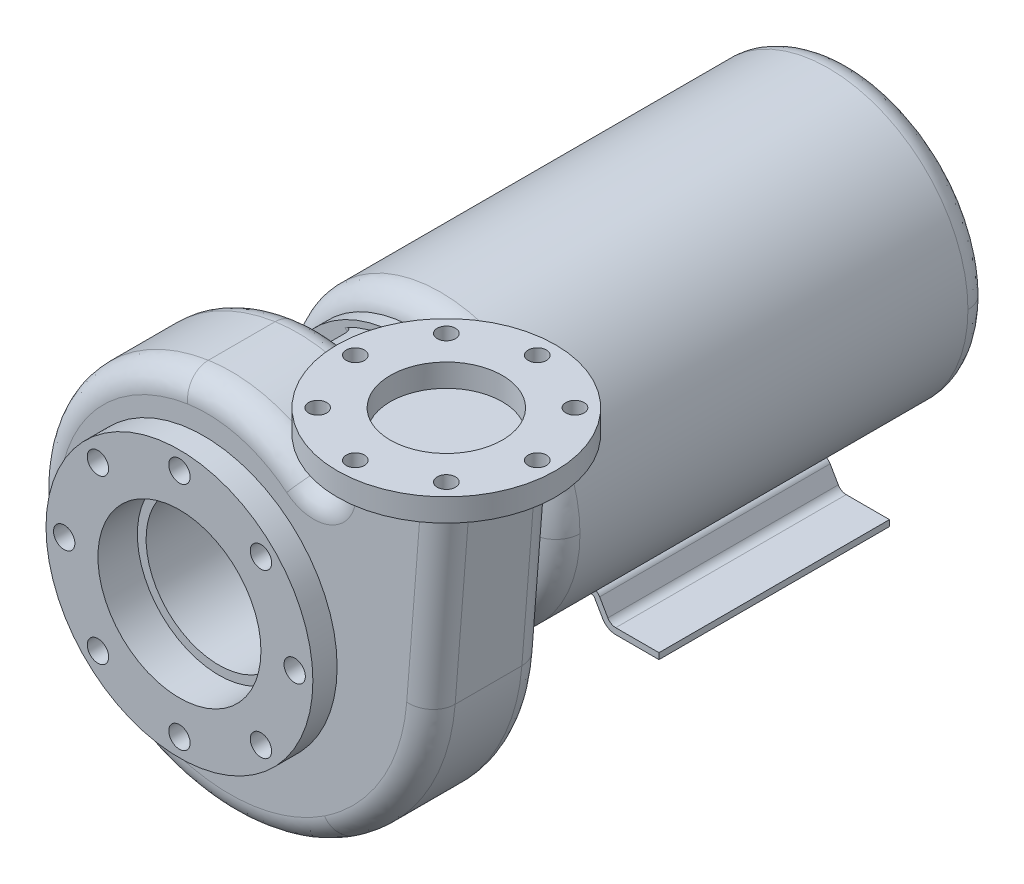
SolidWorks part; units mm, degrees
ref_plane "Front Plane" through (0, 0, 0) normal (0, 0, 1) x (1, 0, 0)
ref_plane "Top Plane" through (0, 0, 0) normal (0, 1, 0) x (1, 0, 0)
ref_plane "Right Plane" through (0, 0, 0) normal (1, 0, 0) x (0, 0, -1)
imported_body "Imported1"
sketch "Sketch1" plane through (0, 0, 76.2) normal (0, 0, 1) x (1, 0, 0)
  circle A0 centre (0, 0) radius 139.7
  dimension "D1" = 279.4
extrude "Extrude1" add sketch "Sketch1" along normal blind 25.4
sketch "Sketch2" plane through (0, 0, 101.6) normal (0, 0, 1) x (1, 0, 0)
  circle A0 centre (0, 0) radius 85.344
  dimension "D1" = 170.688
extrude "Extrude2" cut sketch "Sketch2" against normal up to surface (41.275 mm away)
sketch "Sketch3" plane through (0, 215.9, 0) normal (0, 1, 0) x (1, 0, 0)
  circle A0 centre (177.8, 0) radius 58.674
  dimension "D1" = 117.348
extrude "Cut-Extrude1" cut sketch "Sketch3" against normal up to surface (23.876 mm away)
sketch "Sketch4" plane through (0, 215.9, 0) normal (0, 1, 0) x (1, 0, 0)
  line L0 (177.8, 0) -> (177.8, 95.25) construction
  circle A1 centre (177.8, 95.25) radius 9.525
  circle A2 centre (177.8, 0) radius 95.25 construction
  dimension "D1" = 190.5
  dimension "D2" = 19.05
sketch "Sketch5" plane through (0, 0, 101.6) normal (0, 0, 1) x (1, 0, 0)
  line L0 (0, 0) -> (0, 120.65) construction
  circle A1 centre (0, 120.65) radius 11.176
  circle A2 centre (0, 0) radius 120.65 construction
  dimension "D1" = 22.352
  dimension "D2" = 241.3
extrude "Extrude3" cut sketch "Sketch4" against normal up to next
pattern_circular "CirPattern1" count 8 over 360 about axis through (177.8, 0, 0) along (0, 1, 0) of "Extrude3"
extrude "Extrude4" cut sketch "Sketch5" against normal blind 25.4
pattern_circular "CirPattern2" count 8 over 360 about axis through (0, 0, 0) along (0, 0, 1) of "Extrude4"
